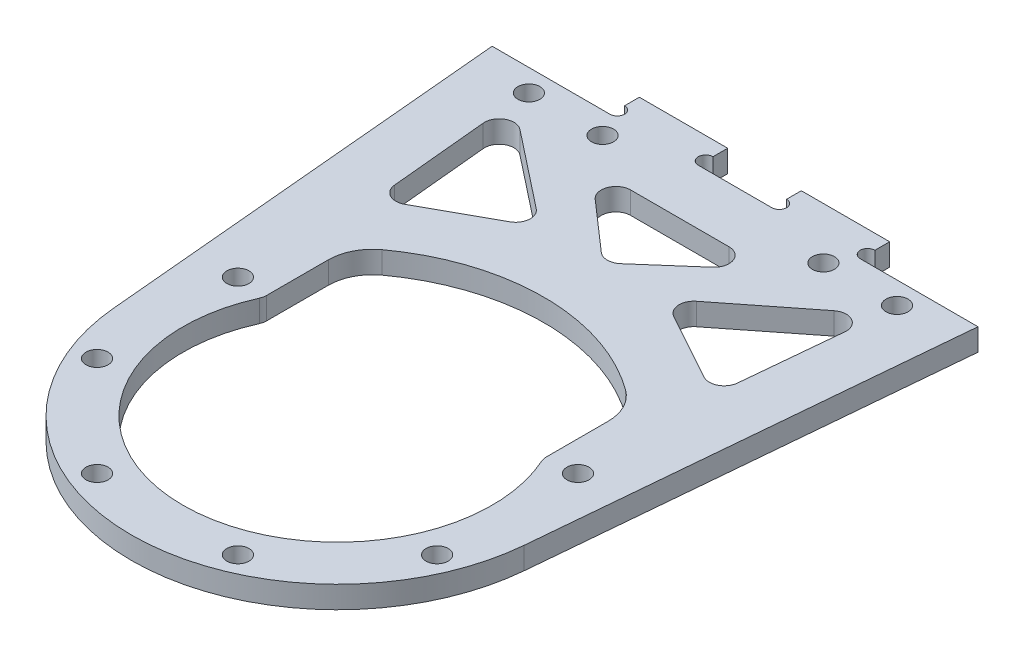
SolidWorks part; units mm, degrees
ref_plane "Front Plane" through (0, 0, 0) normal (0, 0, 1) x (1, 0, 0)
ref_plane "Top Plane" through (0, 0, 0) normal (0, 1, 0) x (1, 0, 0)
ref_plane "Right Plane" through (0, 0, 0) normal (1, 0, 0) x (0, 0, -1)
sketch "Sketch1" plane through (0, 0, 0) normal (0, 1, 0) x (1, 0, 0)
  circle A2 centre (0, 0) radius 28
  circle A3 centre (0, 0) radius 17.5 construction
  circle A4 centre (0, 0) radius 13.5
  circle A5 centre (0, 0) radius 21 construction
  circle A6 centre (0, -17.5) radius 1.5
  circle A7 centre (-17.5, 0) radius 1.5
  circle A8 centre (0, 17.5) radius 1.5
  circle A9 centre (17.5, 0) radius 1.5
  circle A10 centre (0, 0) radius 25 construction
  circle A11 centre (-9.5671, -23.097) radius 1.5
  circle A12 centre (-23.097, -9.5671) radius 1.5
  circle A13 centre (-23.097, 9.5671) radius 1.5
  circle A14 centre (-9.5671, 23.097) radius 1.5
  circle A15 centre (9.5671, 23.097) radius 1.5
  circle A16 centre (23.097, 9.5671) radius 1.5
  circle A17 centre (23.097, -9.5671) radius 1.5
  circle A18 centre (9.5671, -23.097) radius 1.5
  point P4 (0, 0)
  point P5 (0, -25.9504)
  point P6 (-8.6991, -23.4377)
  point P7 (0, 0)
  point P21 (0, 0)
  point P22 (0, 0)
  point P23 (0, 0)
  point P24 (0, 0)
  point P39 (0, 0)
  dimension "D2" = 27
  dimension "D4" = 35
  dimension "D5" = 42
  dimension "D6" = 3
  dimension "D8" = 50
  dimension "D9" = 3
  dimension "D3" = 56
  dimension "D7" = 4
  dimension "D10" = 8
extrude "Boss-Extrude1" add sketch "Sketch1" along normal blind 3
sketch "Sketch5" plane through (0, 0, 0) normal (0, -1, 0) x (1, 0, 0)
  circle A0 centre (0, 0) radius 21
  dimension "D1" = 42
extrude "Cut-Extrude4" cut sketch "Sketch5" against normal blind 10
sketch "Sketch6" plane through (0, 3, 0) normal (0, 1, 0) x (1, 0, 0)
  line L0 (0, 0) -> (0, 54) construction
  line L1 (-33, 54) -> (33, 54)
  line L2 (-33, 54) -> (-27.8861, -2.523)
  line L3 (33, 54) -> (27.8861, -2.523)
  circle A0 centre (0, 0) radius 28 construction
  circle A1 centre (0, 0) radius 28
  point P5 (0, 54)
  dimension "D1" = 54
  dimension "D2" = 66
extrude "Boss-Extrude2" add sketch "Sketch6" against normal through all contours A1 L0 L1 L2 | L0 L3 L1 M9
sketch "Sketch7" plane through (0, 3, 0) normal (0, 1, 0) x (1, 0, 0)
  line L0 (-33, 54) -> (33, 54) construction
  line L1 (-17, 54) -> (-5, 54)
  line L2 (-17, 54) -> (-17, 58)
  line L3 (-17, 58) -> (-5, 58)
  line L4 (-5, 54) -> (-5, 58)
  line L5 (17, 54) -> (5, 54)
  line L6 (17, 54) -> (17, 58)
  line L7 (17, 58) -> (5, 58)
  line L8 (5, 54) -> (5, 58)
  line L9 (-5, 58) -> (5, 58) construction
  point P12 (0, 54)
  point P13 (0, 58)
  dimension "D1" = 12
  dimension "D2" = 4
  dimension "D3" = 10
extrude "Boss-Extrude3" add sketch "Sketch7" against normal through all
sketch "Sketch8" plane through (0, 3, 0) normal (0, 1, 0) x (1, 0, 0)
  line L0 (5, 58) -> (5, 54) construction
  line L7 (-17, 58) -> (-17, 54) construction
  line L8 (-5, 54) -> (-5, 58) construction
  line L9 (17, 54) -> (17, 58) construction
  line L10 (17, 54) -> (33, 54) construction
  line L11 (-5, 54) -> (5, 54) construction
  line L12 (-33, 54) -> (-17, 54) construction
  circle A0 centre (-5, 55) radius 1
  circle A1 centre (5, 55) radius 1
  circle A2 centre (-17, 55) radius 1
  circle A3 centre (17, 55) radius 1
  dimension "D1" = 2
extrude "Cut-Extrude5" cut sketch "Sketch8" against normal through all
sketch "Sketch9" plane through (0, 3, 0) normal (0, 1, 0) x (1, 0, 0)
  line L0 (-33, 54) -> (-17, 54) construction
  circle A0 centre (-25, 51) radius 1.5
  circle A1 centre (-15, 51) radius 1.5
  circle A2 centre (25, 51) radius 1.5
  circle A3 centre (15, 51) radius 1.5
  dimension "D5" = 3
  dimension "D1" = 8
  dimension "D2" = 8
  dimension "D3" = 10
  dimension "D4" = 10
  dimension "D6" = 3
extrude "Cut-Extrude6" cut sketch "Sketch9" against normal through all
sketch "Sketch10" [suppressed] plane through (0, 3, 0) normal (0, 1, 0) x (1, 0, 0)
  circle A0 centre (0, 0) radius 28 construction
  circle A1 centre (0, 0) radius 28
sketch "Sketch12" plane through (0, 3, 0) normal (0, 1, 0) x (1, 0, 0)
  circle A0 centre (9.5671, 23.097) radius 1.5 construction
  circle A1 centre (-9.5671, 23.097) radius 1.5 construction
  circle A2 centre (9.5671, 23.097) radius 1.5
  circle A3 centre (-9.5671, 23.097) radius 1.5
extrude "Boss-Extrude4" add sketch "Sketch12" against normal through all
sketch "Sketch11" plane through (0, 3, 0) normal (0, 1, 0) x (1, 0, 0)
  line L0 (-12, 46.5) -> (12, 46.5)
  line L1 (12, 46.5) -> (0, 36)
  line L2 (0, 36) -> (-12, 46.5)
  line L3 (-25, 49) -> (-8.5, 36)
  line L4 (-8.5, 36) -> (-23, 28)
  line L5 (-23, 28) -> (-25, 49)
  line L6 (25, 49) -> (23, 28)
  line L7 (23, 28) -> (8.5, 36)
  line L8 (8.5, 36) -> (25, 49)
  line L9 (-5, 54) -> (5, 54) construction
  line L10 (-5, 54) -> (5, 54) construction
  line L11 (-33, 54) -> (-17, 54) construction
  line L12 (-8.5, 36) -> (8.5, 36) construction
  line L13 (-23, 28) -> (23, 28) construction
  line L14 (17, 54) -> (33, 54) construction
  line L15 (19, 23.2164) -> (19, 8.9443)
  line L16 (0, -1.65) -> (0, 1.65) construction
  line L17 (-19, 23.2164) -> (-19, 8.9443)
  circle A0 centre (0, 0) radius 21 construction
  circle A1 centre (0, 0) radius 28 construction
  circle A2 centre (0, 0) radius 28
  circle A3 centre (0, 0) radius 21
  circle A4 centre (0, 0) radius 30
  point P11 (25, 51)
  point P13 (0, 36)
  point P21 (0, 46.5)
  point P24 (0, 54)
  point P25 (0, 28)
  point P26 (-24, 23.6772)
  point P27 (-24, 25.8563)
  point P29 (-25, 51)
  point P37 (-24, 26.0119)
  point P38 (0, 33.9498)
  point P39 (19, 23.2164)
  point P40 (-8.5, 35.9998)
  point P41 (-23, 29.1559)
  point P42 (-8.5, 36.122)
  point P46 (0, 0)
  dimension "D6" = 60
  dimension "D1" = 7.5
  dimension "D2" = 24
  dimension "D3" = 5
  dimension "D4" = 17
  dimension "D5" = 38
  dimension "D7" = 46
  dimension "D8" = 26
  dimension "D9" = 18
extrude "Cut-Extrude7" cut sketch "Sketch11" against normal through all
fillet "Fillet2" radius 2 11 edges at (0, 1.5, -36) (12, 1.5, -46.5) (8.5, 1.5, -36) (23, 1.5, -28) (25, 1.5, -49) (-23, 1.5, -28) (-8.5, 1.5, -36) (-25, 1.5, -49) (-12, 1.5, -46.5) (19, 1.5, -8.9443) (-19, 1.5, -8.9443)
fillet "Fillet3" radius 6 2 edges at (19, 1.5, -20.567) (-19, 1.5, -20.567)
